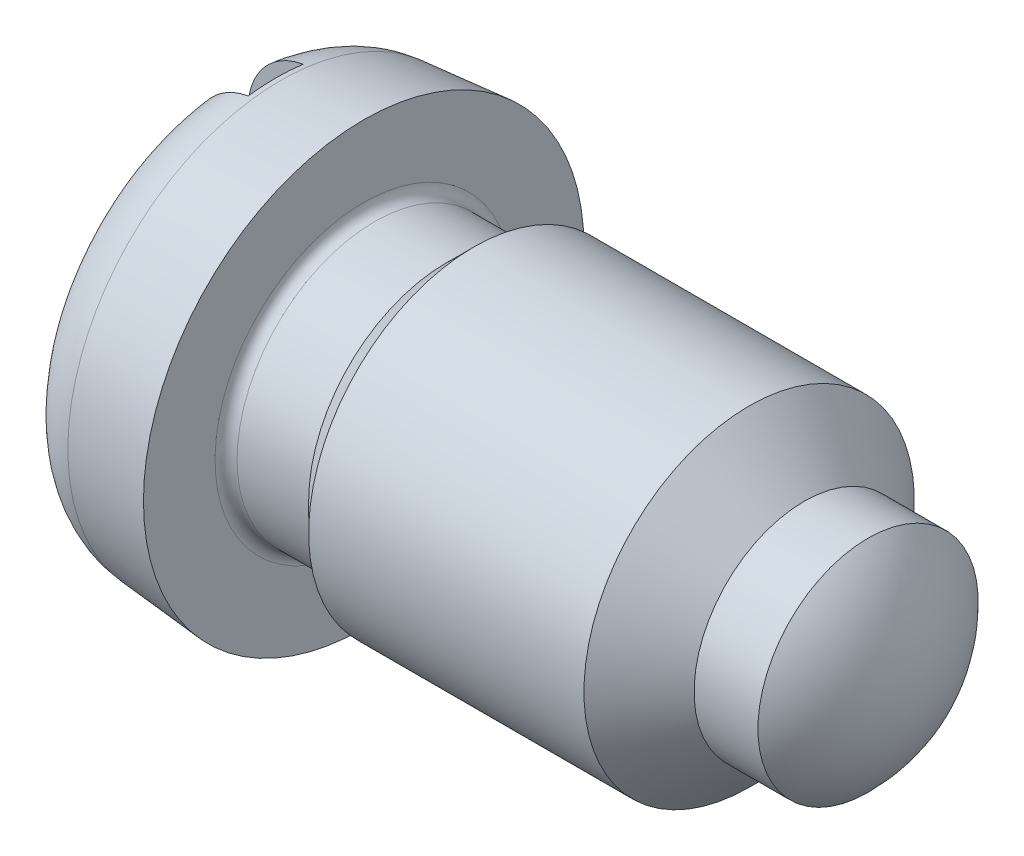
SolidWorks part; units mm, degrees
ref_plane "Front" through (0, 0, 0) normal (0, 0, 1) x (1, 0, 0)
ref_plane "Top" through (0, 0, 0) normal (0, 1, 0) x (1, 0, 0)
ref_plane "Right" through (0, 0, 0) normal (1, 0, 0) x (0, 0, -1)
other "Configuration Table"
sketch "Sketch1" plane through (0, 0, 0) normal (0, 0, 1) x (1, 0, 0)
  line L0 (1.3, 1.5) -> (4.8, 1.5)
  line L1 (4.8, 1.5) -> (5.3, 1)
  line L2 (5.3, 1) -> (5.8798, 1)
  line L3 (1.3, 0) -> (7.8489, 0) construction
  line L4 (1.3, 1.5) -> (1.3, 2)
  line L5 (1.3, 2) -> (0, 1.8863)
  line L6 (0, 0) -> (0, 1.8863)
  line L7 (6.3, 0) -> (0, 0)
  arc A0 (5.8798, 1) -> (6.3, 0) centre (4.9, 0) cw
revolve "Base" add sketch "Sketch1" angle 360 about L3
fillet "Fillet1" radius 0.6 1 edges at (0, -1.8863, 0)
sketch "Sketch3" plane through (0, 0, 0) normal (0, 0, 1) x (1, 0, 0)
  line L0 (1.3, 2) -> (1.3, 1.25)
  line L1 (1.3, -2) -> (1.3, 2) construction
  line L2 (1.3, 1.5) -> (4.8, 1.5) construction
  line L3 (2.3, 1.5) -> (2.3, 2)
  line L4 (2.3, 2) -> (1.3, 2)
  line L5 (0, 0) -> (2.9582, 0) construction
  line L6 (0, 1.3365) -> (0, -1.3365) construction
  line L7 (6.3, 0) -> (0, 0) construction
  line L8 (2.3, 1.5) -> (2.05, 1.25)
  line L9 (2.05, 1.25) -> (1.3, 1.25)
revolve "Cut-Revolve1" cut sketch "Sketch3" angle 360 about L5
fillet "Fillet2" radius 0.1 1 edges at (1.3, -1.25, 0)
sketch "Sketch2" plane through (0, 0, 0) normal (0, -1, 0) x (-1, 0, 0)
  line L0 (-1.6311, 0) -> (0.8061, 0) construction
  line L3 (0, -0.25) -> (-0.5, -0.25)
  line L4 (0, -0.25) -> (0, 0.25)
  line L5 (0, 0.25) -> (-0.5, 0.25)
  line L6 (-0.5, -0.25) -> (-0.5, 0.25)
  dimension "n" = 0.5
  dimension "t" = 0.5
extrude "Slot" cut sketch "Sketch2" against normal through all and the other way through all
sketch "Sketch4" plane through (0, 0, 0) normal (0, 0, 1) x (1, 0, 0)
  line L0 (4.8, 1.067) -> (5.05, 1.5)
  line L1 (5.05, 1.5) -> (5.05, 2)
  line L2 (5.05, 2) -> (4.55, 2)
  line L3 (4.55, 2) -> (4.55, 1.5)
  line L4 (4.55, 1.5) -> (4.8, 1.067)
  line L5 (4.8, -1.5) -> (4.8, 1.5) construction
  line L6 (4.8, 1.5) -> (2.3, 1.5) construction
  line L7 (0, 0) -> (8.3043, 0) construction
  line L8 (0, 1.3129) -> (0, -1.3129) construction
revolve "Cut-Revolve10" [suppressed] cut sketch "Sketch4" angle 360 about L7
pattern_linear "LPattern10" [suppressed] count 5 spacing 0.6 along (1, 0, 0)
equation "\"D3@Sketch3\" =  ( \"d@Sketch1\" + \"D2@ThreadCosmetic1\" )  / 2"
equation "\"D1@Sketch4\" =  ( \"d@Sketch1\" - \"D2@ThreadCosmetic1\" )  / 2"
equation "\"D3@LPattern10\" = \"D1@Sketch4\" * 1.2"
equation "\"D1@LPattern10\" =  ( \"l@Sketch1\" - \"a@Sketch3\" )  / \"D3@LPattern10\""
